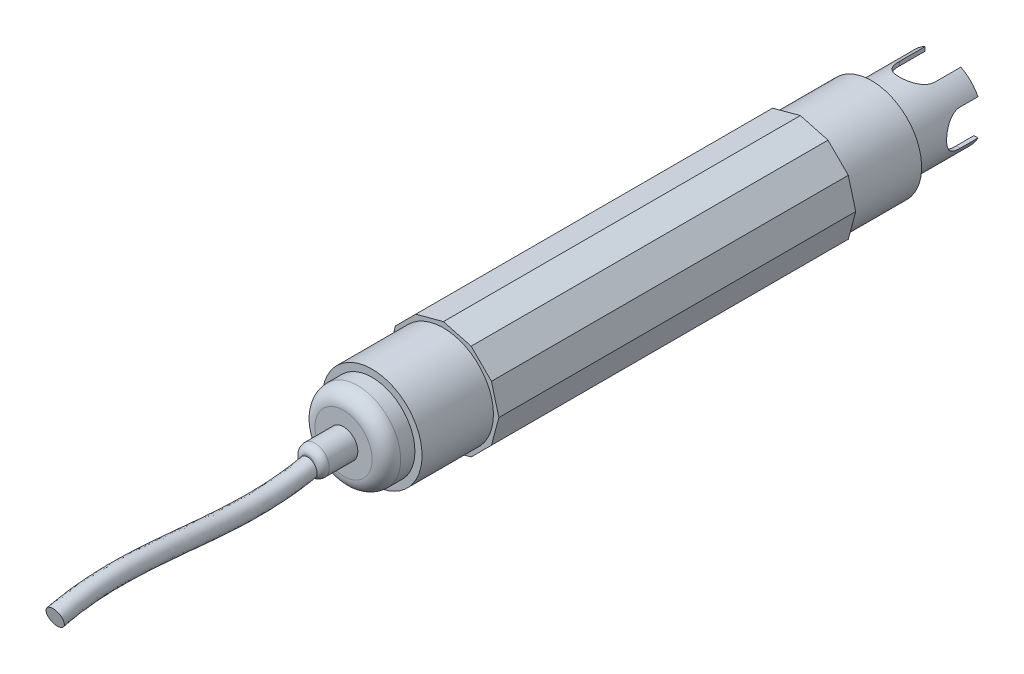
SolidWorks part; units mm, degrees
ref_plane "Front Plane" through (0, 0, 0) normal (0, 0, 1) x (1, 0, 0)
ref_plane "Top Plane" through (0, 0, 0) normal (0, 1, 0) x (1, 0, 0)
ref_plane "Right Plane" through (0, 0, 0) normal (1, 0, 0) x (0, 0, -1)
sketch "Sketch1" plane through (0, 0, 0) normal (0, 0, 1) x (1, 0, 0)
  line L0 (-15.5291, 0) -> (-13.4486, -7.7646)
  line L1 (15.5291, 0) -> (13.4486, 7.7646)
  line L2 (13.4486, 7.7646) -> (7.7646, 13.4486)
  line L3 (7.7646, 13.4486) -> (0, 15.5291)
  line L4 (0, 15.5291) -> (-7.7646, 13.4486)
  line L5 (-7.7646, 13.4486) -> (-13.4486, 7.7646)
  line L6 (-13.4486, 7.7646) -> (-15.5291, 0)
  line L7 (-13.4486, -7.7646) -> (-7.7646, -13.4486)
  line L8 (-7.7646, -13.4486) -> (0, -15.5291)
  line L9 (0, -15.5291) -> (7.7646, -13.4486)
  line L10 (7.7646, -13.4486) -> (13.4486, -7.7646)
  line L11 (13.4486, -7.7646) -> (15.5291, 0)
  circle A0 centre (0, 0) radius 15 construction
extrude "Boss-Extrude1" add sketch "Sketch1" against normal blind 100
sketch "Sketch2" plane through (0, 0, 0) normal (0, 0, 1) x (1, 0, 0)
  circle A0 centre (0, 0) radius 14
  dimension "D1" = 28
extrude "Boss-Extrude2" add sketch "Sketch2" along normal blind 20
sketch "Sketch3" plane through (0, 0, 20) normal (0, 0, 1) x (1, 0, 0)
  circle A0 centre (0, 0) radius 12
extrude "Boss-Extrude3" add sketch "Sketch3" along normal blind 8
fillet "Fillet1" radius 4 1 edges at (12, 0, 28)
sketch "Sketch4" plane through (0, 0, 28) normal (0, 0, 1) x (1, 0, 0)
  circle A0 centre (0, 0) radius 4
extrude "Boss-Extrude4" add sketch "Sketch4" along normal blind 10
fillet "Fillet2" radius 2 1 edges at (4, 0, 38)
sketch "Sketch6" plane through (0, 0, -100) normal (0, 0, -1) x (-1, 0, 0)
  circle A0 centre (0, 0) radius 14
extrude "Boss-Extrude6" add sketch "Sketch6" along normal blind 20
sketch "Sketch7" plane through (0, 0, -120) normal (0, 0, -1) x (-1, 0, 0)
  circle A0 centre (0, 0) radius 10
  circle A1 centre (0, 0) radius 11
  dimension "D1" = 1
extrude "Boss-Extrude7" add sketch "Sketch7" along normal blind 20
sketch "Sketch8" plane through (0, 0, 0) normal (1, 0, 0) x (0, 0, -1)
  line L0 (140, -11) -> (140, 11) construction
  line L1 (145, -5) -> (135, -5)
  line L2 (145, -5) -> (145, 5)
  line L3 (145, 5) -> (135, 5)
  line L5 (145, -5) -> (135, 5) construction
  line L6 (145, 5) -> (135, -5) construction
  arc A0 (135, 5) -> (135, -5) centre (135, 0) ccw
  point P0 (140, 0)
  dimension "D1" = 10
extrude "Cut-Extrude1" cut sketch "Sketch8" against normal up to next and the other way up to next
sketch "Sketch9" plane through (0, 0, 0) normal (0, 1, 0) x (1, 0, 0)
  line L0 (9.798, 140) -> (-9.798, 140) construction
  line L2 (-5, 132.7558) -> (-5, 147.2442)
  line L3 (-5, 147.2442) -> (5, 147.2442)
  line L4 (5, 132.7558) -> (5, 147.2442)
  line L5 (-5, 132.7558) -> (5, 147.2442) construction
  line L6 (-5, 147.2442) -> (5, 132.7558) construction
  arc A0 (-5, 132.7558) -> (5, 132.7558) centre (0, 132.7558) ccw
  point P0 (0, 140)
  dimension "D1" = 10
extrude "Cut-Extrude2" cut sketch "Sketch9" against normal up to next and the other way up to next
sketch "Sketch10" plane through (0, 0, -120) normal (0, 0, -1) x (-1, 0, 0)
  circle A0 centre (0, 0) radius 10
extrude "Boss-Extrude8" add sketch "Sketch10" along normal blind 8
sketch "Sketch11" plane through (0, 0, -128) normal (0, 0, -1) x (-1, 0, 0)
  circle A0 centre (0, 0) radius 3
extrude "Boss-Extrude9" add sketch "Sketch11" along normal blind 6
fillet "Fillet3" radius 3 1 edges at (-3, 0, -134)
sketch "Sketch23" plane through (0, 0, 0) normal (1, 0, 0) x (0, 0, -1)
  spline S0 degree 3 poles (-34.2183, 0) (-59.081, -6.9051) (-83.9859, 4.2525) (-108.8162, -1.8443) knots 0 0 0 0 1 1 1 1
  point P2 (-108.8162, -1.8443)
  point P4 (-81.6263, -3.0062)
  point P6 (-64.1969, 0)
  point P7 (-34.2183, 0)
  point P8 (-61.1758, -2.0767)
  point P9 (-88.1333, 0)
sweep "Sweep1" add path "Sketch23" parameters "D3"=5
